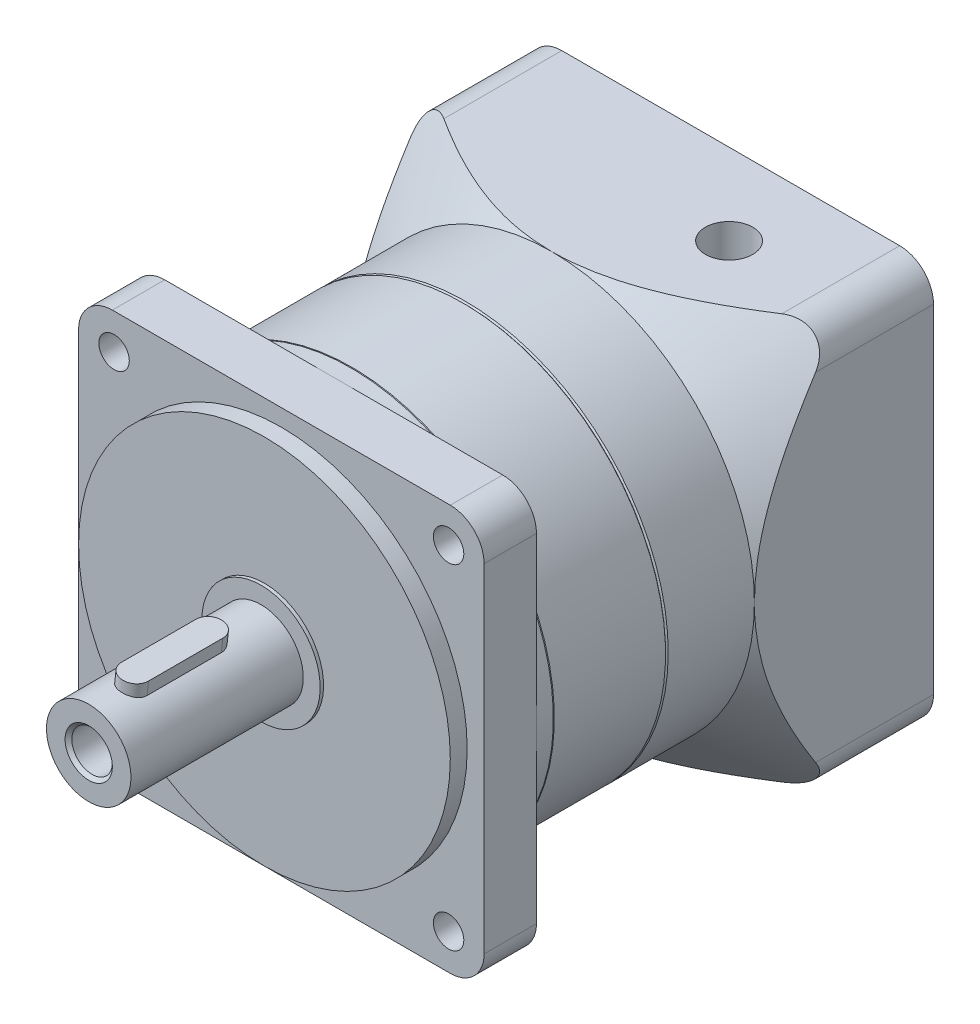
SolidWorks part; units mm, degrees
ref_plane "前基準面" through (0, 0, 0) normal (0, 0, 1) x (1, 0, 0)
ref_plane "上基準面" through (0, 0, 0) normal (0, 1, 0) x (1, 0, 0)
ref_plane "右基準面" through (0, 0, 0) normal (1, 0, 0) x (0, 0, -1)
imported_body "AT-1-solid1"
ref_plane "平面1" through (0, -22.1507, 0) normal (0, -1, 0) x (1, 0, 0)
sketch "草圖1" plane through (0, -22.1507, 0) normal (0, -1, 0) x (1, 0, 0)
  line L0 (99.826, 282.8706) -> (40.126, 282.8706)
  line L1 (40.126, 282.8706) -> (40.126, 249.3706)
  line L2 (40.126, 249.3706) -> (99.826, 249.3706)
  line L3 (99.826, 249.3706) -> (100.126, 249.6706)
  line L4 (100.126, 249.6706) -> (100.126, 282.5706)
  line L5 (100.126, 282.5706) -> (99.826, 282.8706)
  line L6 (40.126, 282.8706) -> (40.126, 249.3706) construction
revolve "旋轉1" add sketch "草圖1" angle 360 about L6
imported_body "AF-1-solid1"
imported_body "AB-1-solid1"
